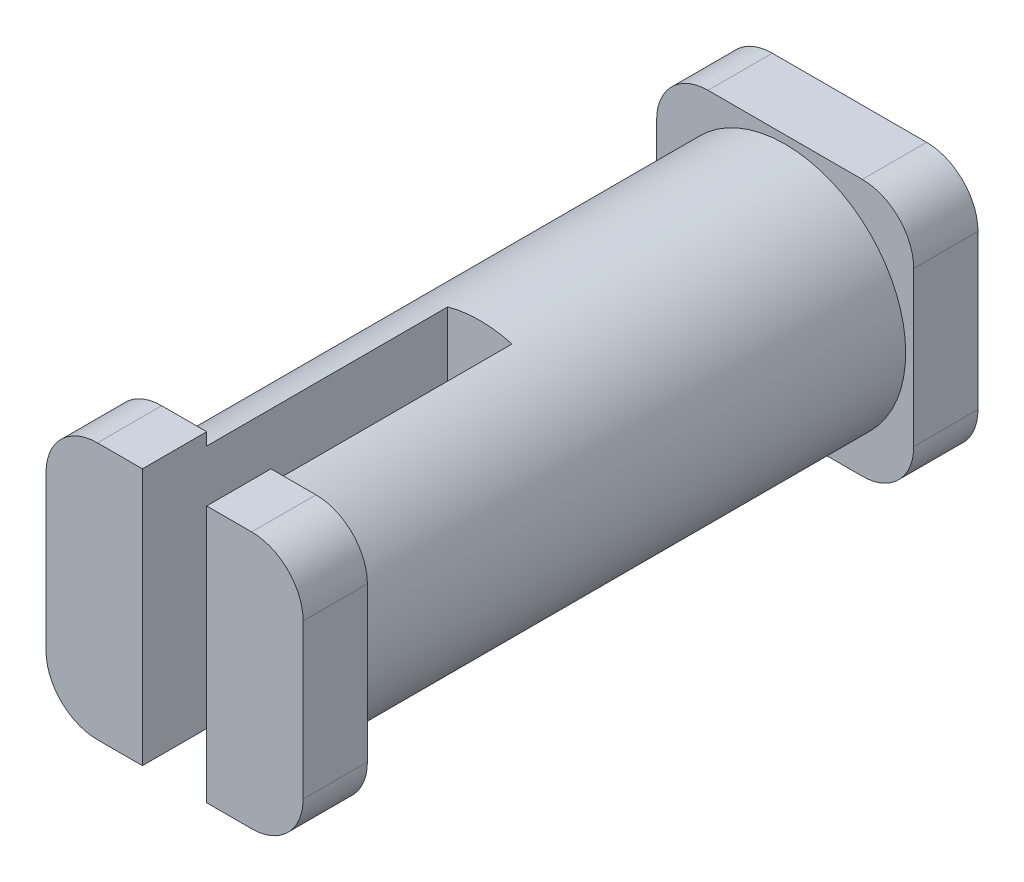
SolidWorks part; units mm, degrees
ref_plane "Front Plane" through (0, 0, 0) normal (0, 0, 1) x (1, 0, 0)
ref_plane "Top Plane" through (0, 0, 0) normal (0, 1, 0) x (1, 0, 0)
ref_plane "Right Plane" through (0, 0, 0) normal (1, 0, 0) x (0, 0, -1)
sketch "Sketch1" plane through (0, 0, 0) normal (0, 0, 1) x (1, 0, 0)
  line L1 (1.27, 0) -> (5.08, 0)
  line L2 (0, 1.27) -> (0, 5.08)
  line L3 (1.27, 6.35) -> (5.08, 6.35)
  line L4 (6.35, 1.27) -> (6.35, 5.08)
  arc A0 (5.08, 0) -> (6.35, 1.27) centre (5.08, 1.27) ccw
  arc A1 (1.27, 0) -> (0, 1.27) centre (1.27, 1.27) cw
  arc A2 (0, 5.08) -> (1.27, 6.35) centre (1.27, 5.08) cw
  arc A3 (5.08, 6.35) -> (6.35, 5.08) centre (5.08, 5.08) cw
  point P7 (6.35, 0)
  point P10 (0, 0)
  point P13 (0, 6.35)
  point P16 (6.35, 6.35)
  dimension "D3" = 1.27
  dimension "D1" = 6.35
  dimension "D2" = 6.35
extrude "Boss-Extrude1" add sketch "Sketch1" along normal blind 1.5875
sketch "Sketch2" plane through (0, 0, 1.5875) normal (0, 0, 1) x (1, 0, 0)
  line L0 (0, 5.08) -> (0, 1.27) construction
  line L1 (5.08, 6.35) -> (1.27, 6.35) construction
  circle A0 centre (3.175, 3.175) radius 2.9766
  point P5 (0, 3.175)
  point P9 (3.175, 6.35)
  dimension "D1" = 5.9531
extrude "Boss-Extrude2" add sketch "Sketch2" along normal blind 13.4937
ref_plane "Plane1" through (0, 0, 8.3344) normal (0, 0, 1) x (1, 0, 0)
mirror "Mirror1" about plane through (0, 0, 8.3344) normal (0, 0, 1) of "Boss-Extrude1"
sketch "Sketch3" plane through (0, 0, 16.6687) normal (0, 0, 1) x (1, 0, 0)
  line L0 (5.08, 6.35) -> (1.27, 6.35) construction
  line L1 (2.3813, 6.35) -> (3.9688, 6.35)
  line L2 (2.3813, 6.35) -> (2.3813, 0)
  line L3 (2.3813, 0) -> (3.9688, 0)
  line L4 (3.9688, 6.35) -> (3.9688, 0)
  line L5 (1.27, 0) -> (5.08, 0) construction
  line L6 (3.175, 0) -> (3.175, -0.924) construction
  point P12 (3.175, 0)
  dimension "D1" = 1.5875
extrude "Cut-Extrude1" cut sketch "Sketch3" against normal blind 7.5406
